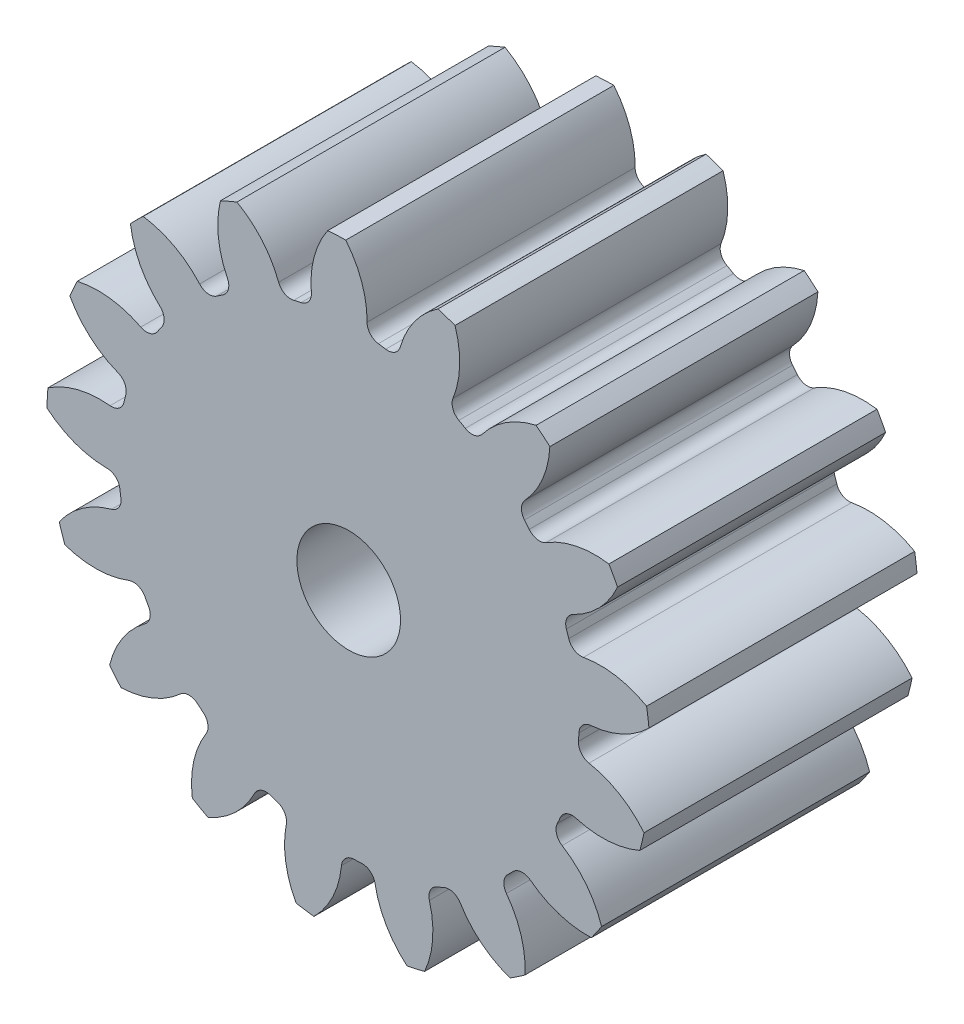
SolidWorks part; units mm, degrees
ref_plane "Front" through (0, 0, 0) normal (0, 0, 1) x (1, 0, 0)
ref_plane "Top" through (0, 0, 0) normal (0, 1, 0) x (1, 0, 0)
ref_plane "Right" through (0, 0, 0) normal (1, 0, 0) x (0, 0, -1)
sketch "Sketch3" plane through (0, 0, 0) normal (0, 0, 1) x (1, 0, 0)
  circle A0 centre (0, 0) radius 107.2444
  dimension "od" = 214.4889
extrude "gearBody" add sketch "Sketch3" along normal blind 95.25
sketch "Sketch2" plane through (0, 0, 0) normal (0, 0, 1) x (1, 0, 0)
  line L0 (0, 0) -> (83.305, 34.5061) construction
  line L1 (105.4319, -22.7569) -> (0, 0) construction
  line L2 (0, 0) -> (36.3143, 0) construction
  line L3 (95.881, 3.7822) -> (94.9467, -13.8775) construction
  line L5 (95.4139, -5.0476) -> (0, 0) construction
  line L7 (0, 0) -> (90.1687, 0) construction
  arc A0 (90.1461, 2.0205) -> (89.4297, -11.5206) centre (0, 0) ccw construction
  arc A1 (106.6852, 10.9375) -> (104.9357, -22.1328) centre (0, 0) ccw construction
  arc A2 (95.881, 3.7822) -> (94.9467, -13.8775) centre (0, 0) ccw construction
  arc A3 (81.649, -5.6532) -> (81.7897, -2.9931) centre (0, 0) ccw
  arc A4 (105.4319, -22.7569) -> (85.3775, -10.4849) centre (79.1993, -43.103) ccw
  arc A5 (105.4319, -22.7569) -> (107.2444, 11.5058) centre (0, 0) ccw
  arc A6 (107.2444, 11.5058) -> (86.0072, 1.4182) centre (83.305, 34.5061) cw
  arc A7 (81.7897, -2.9931) -> (86.0072, 1.4182) centre (86.3812, -3.1611) cw
  arc A8 (85.3775, -10.4849) -> (81.649, -5.6532) centre (86.2326, -5.9706) cw
  point P6 (107.2444, 11.5058)
  point P22 (105.4319, -22.7569)
  dimension "baseDia" = 180.3375
  dimension "od" = 214.4889
  dimension "pd" = 191.9111
  dimension "rd" = 163.6889
  dimension "rFillet" = 4.5946
  dimension "pointX" = 107.2444
  dimension "pointY" = 11.5058
  dimension "CTT" = 17.6597
  dimension "flankCenterAngle" = 22.5
extrude "toothCut" cut sketch "Sketch2" along normal through all
pattern_circular "CirPattern1" count 17 over 360 about axis through (0, 0, 0) along (0, 0, 1) of "toothCut"
sketch "hub1Dia" plane through (0, 0, 0) normal (0, 0, -1) x (-1, 0, 0)
  circle A0 centre (0, 0) radius 12.7
  dimension "hub1Dia" = 25.4
sketch "hub2Dia" plane through (0, 0, 95.25) normal (0, 0, 1) x (1, 0, 0)
  circle A0 centre (0, 0) radius 12.7
  dimension "hub2dia" = 25.4
sketch "boreDia" plane through (0, 0, 0) normal (0, 0, 1) x (1, 0, 0)
  circle A0 centre (0, 0) radius 18.415
  dimension "boreDia" = 36.83
extrude "bore" cut sketch "boreDia" against normal mid plane 25400
